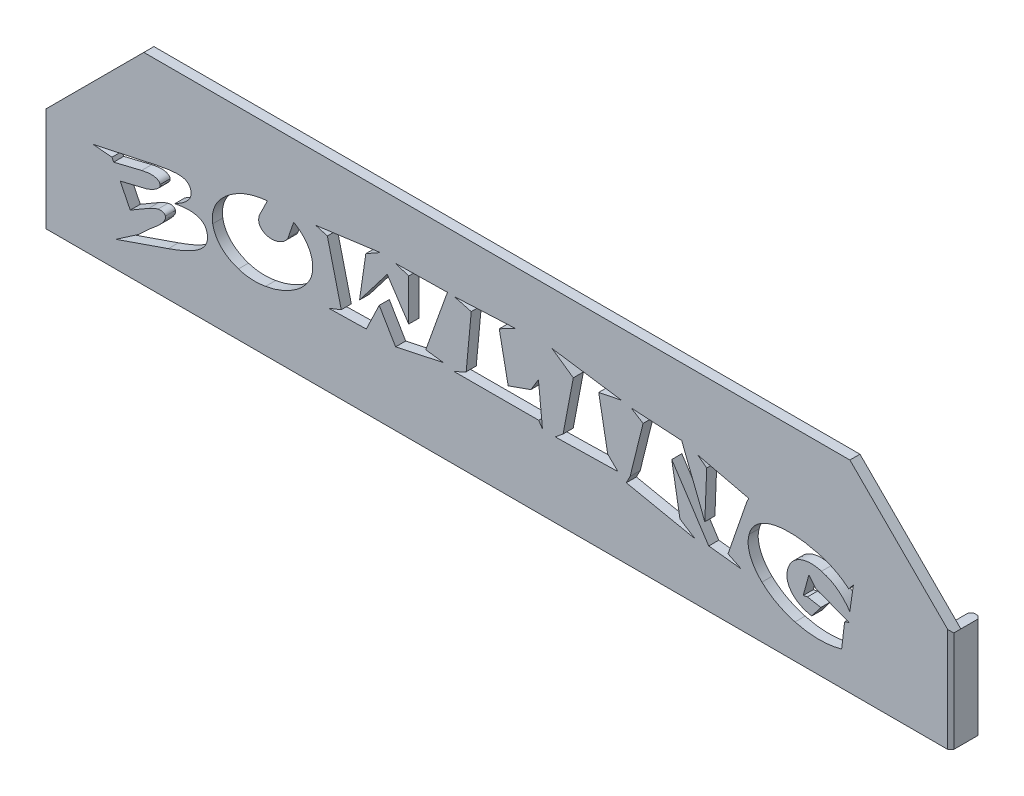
SolidWorks part; units mm, degrees
ref_plane "Plan de face" through (0, 0, 0) normal (0, 0, 1) x (1, 0, 0)
ref_plane "Plan de dessus" through (0, 0, 0) normal (0, 1, 0) x (1, 0, 0)
ref_plane "Plan de droite" through (0, 0, 0) normal (1, 0, 0) x (0, 0, -1)
sketch "Esquisse1" plane through (0, 0, 0) normal (0, 0, 1) x (1, 0, 0)
  line L0 (-90, 0) -> (90, 0)
  line L5 (90, 0) -> (90, 20)
  line L6 (90, 20) -> (70, 40)
  line L7 (70, 40) -> (-70, 40)
  line L8 (-70, 40) -> (-90, 20)
  line L9 (-90, 20) -> (-90, 0)
  point P5 (0, 0)
  dimension "D1" = 180
  dimension "D2" = 40
  dimension "D3" = 20
extrude "Boss.-Extru.1" add sketch "Esquisse1" along normal blind 2
sketch "Esquisse5" plane through (0, 0, 2) normal (0, 0, 1) x (1, 0, 0)
  line L2 (-65.1345, 8.7322) -> (-75.5242, 5.1366)
  line L3 (-75.5242, 5.1366) -> (-71.0282, 8.2263)
  line L5 (-76.3245, 18.8418) -> (-80.1002, 19.1705)
  line L6 (-80.1002, 19.1705) -> (-67.6497, 21.8601)
  line L8 (-10.188, 27.8475) -> (-14.0952, 16.8862)
  line L9 (-14.0952, 16.8862) -> (-10.611, 16.4318)
  line L10 (-10.611, 16.4318) -> (-20.0804, 14.391)
  line L11 (-20.0804, 14.391) -> (-23.3273, 19.9017)
  line L12 (-23.3273, 19.9017) -> (-25.894, 14.5453)
  line L13 (-25.894, 14.5453) -> (-33.3197, 14.3967)
  line L14 (-33.3197, 14.3967) -> (-30.8559, 15.3828)
  line L15 (-30.8559, 15.3828) -> (-33.6141, 26.6642)
  line L16 (-33.6141, 26.6642) -> (-35.9235, 27.3445)
  line L17 (-35.9235, 27.3445) -> (-23.1015, 29.0709)
  line L18 (-23.1015, 29.0709) -> (-25.9855, 27.4503)
  line L19 (-25.9855, 27.4503) -> (-27.2345, 18.8555)
  line L20 (-27.2345, 18.8555) -> (-21.7439, 26.0269)
  line L21 (-21.7439, 26.0269) -> (-17.4765, 19.5987)
  line L22 (-17.4765, 19.5987) -> (-17.4765, 27.8647)
  line L23 (-17.4765, 27.8647) -> (-20.1089, 28.725)
  line L24 (-20.1089, 28.725) -> (-9.7751, 28.8944)
  line L25 (9.0436, 14.8356) -> (8.3061, 15.9793)
  line L26 (8.3061, 15.9793) -> (-8.4174, 15.9564)
  line L27 (-8.4174, 15.9564) -> (-6.088, 17.1025)
  line L28 (-6.088, 17.1025) -> (-5.079, 27.9495)
  line L29 (-5.079, 27.9495) -> (-8.4632, 28.8499)
  line L30 (-8.4632, 28.8499) -> (3.6958, 29.433)
  line L31 (3.6958, 29.433) -> (0.466, 27.7666)
  line L32 (0.466, 27.7666) -> (2.2409, 18.8632)
  line L33 (2.2409, 18.8632) -> (6.7283, 20.4467)
  line L34 (6.7283, 20.4467) -> (8.2403, 22.9276)
  line L35 (8.2403, 22.9276) -> (9.0436, 14.8356)
  line L36 (24.0133, 15.0116) -> (11.5788, 14.7599)
  line L37 (11.5788, 14.7599) -> (13.1346, 16.0389)
  line L38 (13.1346, 16.0389) -> (15.1582, 26.6973)
  line L39 (15.1582, 26.6973) -> (10.9509, 29.6155)
  line L40 (10.9509, 29.6155) -> (24.7297, 27.6249)
  line L41 (24.7297, 27.6249) -> (20.1972, 26.7087)
  line L42 (20.1972, 26.7087) -> (21.9779, 17.005)
  line L43 (21.9779, 17.005) -> (24.0133, 15.0116)
  line L44 (49.9568, 23.3834) -> (49.5827, 22.6563)
  line L45 (49.5827, 22.6563) -> (45.8356, 11.8151)
  line L46 (45.8356, 11.8151) -> (48.4652, 10.5146)
  line L47 (48.4652, 10.5146) -> (42.0141, 11.2463)
  line L48 (42.0141, 11.2463) -> (34.6742, 22.4277)
  line L49 (34.6742, 22.4277) -> (36.3091, 13.0127)
  line L50 (36.3091, 13.0127) -> (39.3188, 11.1148)
  line L51 (39.3188, 11.1148) -> (25.6657, 13.9257)
  line L53 (26.4279, 15.426) -> (28.9917, 25.7871)
  line L54 (28.9917, 25.7871) -> (26.6303, 27.2635)
  line L55 (26.6303, 27.2635) -> (36.646, 26.6732)
  line L56 (36.646, 26.6732) -> (41.2335, 15.0116)
  line L57 (41.2335, 15.0116) -> (41.6108, 24.4409)
  line L58 (41.6108, 24.4409) -> (39.793, 25.7957)
  line L59 (39.793, 25.7957) -> (49.9568, 23.3834)
  line L60 (69.8672, 12.0374) -> (68.9433, 11.6799)
  line L61 (68.9433, 11.6799) -> (68.363, 6.7094)
  line L62 (69.7607, 17.7593) -> (70.6868, 18.8998)
  line L63 (70.6868, 18.8998) -> (69.9824, 13.9257)
  line L64 (62.4379, 9.4304) -> (64.2415, 11.7999)
  line L65 (64.2415, 11.7999) -> (61.5776, 12.283)
  line L66 (61.5776, 12.283) -> (60.739, 12.1058)
  line L67 (60.739, 12.1058) -> (61.8691, 16.2102)
  line L68 (61.8691, 16.2102) -> (63.222, 14.5453)
  line L69 (63.222, 14.5453) -> (69.8672, 12.0374)
  line L70 (-10.188, 27.8475) -> (-9.7751, 28.8944)
  line L72 (26.4279, 15.426) -> (25.6657, 13.9257)
  line L73 (-46.7742, 24.1553) -> (-45.4965, 26.7449)
  line L75 (-46.9028, 26.5791) -> (-45.4965, 26.7449)
  line L78 (-41.395, 22.4804) -> (-40.2894, 25.691)
  line L79 (-70.4394, 19.5049) -> (-75.9818, 18.1549)
  line L80 (-69.419, 16.8439) -> (-74.6874, 15.5606)
  line L81 (-69.036, 13.697) -> (-72.6959, 11.569)
  line L82 (-68.6873, 10.4014) -> (-71.0282, 8.2263)
  line L83 (-75.9818, 18.1549) -> (-76.3245, 18.8418)
  line L85 (-72.6959, 11.569) -> (-74.6874, 15.5606)
  spline S0 degree 3 poles (-68.6873, 10.4014) (-68.4284, 10.6047) (-68.0569, 10.9053) (-67.5898, 11.3091) (-67.2791, 11.5883) (-66.9949, 11.8539) (-66.74, 12.1081) (-66.5146, 12.3508) (-66.3159, 12.5794) (-66.1455, 12.7976) (-66.0038, 13.0056) (-65.8833, 13.2001) (-65.7947, 13.3853) (-65.7327, 13.5596) (-65.686, 13.769) (-65.692, 13.9247) (-65.7147, 14.0199) knots 0 0 0 0 0.2042 0.296389 0.383025 0.463309 0.537702 0.60629 0.668733 0.7256 0.777898 0.82483 0.867394 0.904967 0.939396 1 1 1 1
  spline S1 degree 3 poles (-65.7147, 14.0199) (-65.7435, 14.1306) (-65.837, 14.2885) (-66.0435, 14.425) (-66.236, 14.5022) (-66.4574, 14.5493) (-66.7907, 14.5682) (-67.0466, 14.5265) (-67.2182, 14.483) knots 0 0 0 0 0.198119 0.302488 0.423844 0.555583 0.6928 1 1 1 1
  spline S2 degree 3 poles (-67.2182, 14.483) (-67.5118, 14.408) (-67.9582, 14.2378) (-68.5591, 13.9599) (-68.8759, 13.79) (-69.036, 13.697) knots 0 0 0 0 0.457042 0.720468 1 1 1 1
  spline S3 degree 3 poles (-69.419, 16.8439) (-69.0237, 16.9869) (-68.4661, 17.2145) (-67.7991, 17.5882) (-67.457, 17.8277) (-67.2246, 18.0235) (-67.0812, 18.1622) (-66.9653, 18.2987) (-66.8723, 18.4283) (-66.8078, 18.5565) (-66.7562, 18.7169) (-66.7616, 18.8406) (-66.778, 18.9161) knots 0 0 0 0 0.35546 0.507236 0.645274 0.707533 0.763891 0.813576 0.858687 0.898289 0.934453 1 1 1 1
  spline S4 degree 3 poles (-66.778, 18.9161) (-66.8038, 19.0218) (-66.8746, 19.1706) (-67.0127, 19.3414) (-67.1441, 19.4511) (-67.3014, 19.5424) (-67.4831, 19.6191) (-67.6889, 19.6817) (-67.919, 19.7257) (-68.1691, 19.7573) (-68.4394, 19.7708) (-68.7276, 19.7677) (-69.0346, 19.7461) (-69.3599, 19.7126) (-69.704, 19.6601) (-70.0663, 19.5914) (-70.3132, 19.5356) (-70.4394, 19.5049) knots 0 0 0 0 0.080612 0.120925 0.16269 0.2072 0.255804 0.30919 0.367042 0.429929 0.496679 0.568303 0.644339 0.725624 0.811669 0.903319 1 1 1 1
  spline S5 degree 3 poles (-63.8654, 17.0811) (-63.4316, 17.1749) (-62.7948, 17.2793) (-61.9652, 17.3749) (-61.3982, 17.4048) (-60.8659, 17.4096) (-60.3689, 17.3834) (-59.9078, 17.3195) (-59.4823, 17.2305) (-59.0951, 17.1067) (-58.7426, 16.9577) (-58.4322, 16.7703) (-58.1604, 16.5548) (-57.927, 16.3091) (-57.6716, 15.9305) (-57.5445, 15.6075) (-57.4859, 15.3833) knots 0 0 0 0 0.182781 0.2657 0.343928 0.416542 0.484951 0.548731 0.608164 0.663775 0.715984 0.76546 0.81266 0.858475 0.904526 1 1 1 1
  spline S6 degree 3 poles (-57.4859, 15.3833) (-57.4045, 15.0727) (-57.3441, 14.5959) (-57.4135, 13.9691) (-57.5396, 13.5206) (-57.7337, 13.0843) (-58.0002, 12.6618) (-58.3386, 12.2542) (-58.7513, 11.8604) (-59.2417, 11.4713) (-59.8193, 11.0841) (-60.4857, 10.695) (-61.2414, 10.3026) (-62.087, 9.9118) (-63.3835, 9.3582) (-64.4164, 8.9827) (-65.1345, 8.7322) knots 0 0 0 0 0.086802 0.128255 0.169668 0.212199 0.256846 0.304216 0.355016 0.410704 0.473185 0.542774 0.619121 0.703203 0.794445 1 1 1 1
  spline S7 degree 3 poles (-67.6497, 21.8601) (-67.0989, 21.9811) (-66.3023, 22.1341) (-65.2791, 22.3011) (-64.6089, 22.3876) (-64.0006, 22.4425) (-63.457, 22.4709) (-62.9759, 22.4659) (-62.554, 22.4346) (-62.1814, 22.3686) (-61.8506, 22.273) (-61.5583, 22.1447) (-61.3051, 21.983) (-61.0915, 21.7892) (-60.8489, 21.4871) (-60.7405, 21.2116) (-60.69, 21.0226) knots 0 0 0 0 0.221364 0.318321 0.406917 0.486517 0.558025 0.620483 0.675267 0.723902 0.768749 0.810099 0.848792 0.886124 0.922861 1 1 1 1
  spline S8 degree 3 poles (-60.69, 21.0226) (-60.6492, 20.8575) (-60.612, 20.6031) (-60.6363, 20.264) (-60.6857, 20.0127) (-60.7664, 19.762) (-60.8817, 19.5126) (-61.032, 19.2666) (-61.2142, 19.023) (-61.4266, 18.7777) (-61.6778, 18.5372) (-61.9566, 18.2899) (-62.2734, 18.0479) (-62.6224, 17.8046) (-63.1513, 17.4725) (-63.569, 17.2301) (-63.8654, 17.0811) knots 0 0 0 0 0.093707 0.139931 0.186385 0.234281 0.284461 0.337127 0.392573 0.451632 0.515373 0.583701 0.656551 0.734473 0.817632 1 1 1 1
  spline S9 degree 3 poles (-46.7742, 24.1553) (-46.8677, 24.0073) (-46.9844, 23.7751) (-47.1069, 23.4553) (-47.1687, 23.2144) (-47.2095, 22.9743) (-47.2312, 22.6565) (-47.221, 22.4187) (-47.1915, 22.2632) knots 0 0 0 0 0.26485 0.392709 0.518019 0.640912 0.761002 1 1 1 1
  spline S10 degree 3 poles (-47.1915, 22.2632) (-47.1679, 22.1266) (-47.1085, 21.9255) (-46.9774, 21.6795) (-46.8543, 21.5066) (-46.7021, 21.3498) (-46.5314, 21.1989) (-46.331, 21.0666) (-46.1137, 20.9407) (-45.8791, 20.8337) (-45.634, 20.7474) (-45.3825, 20.6822) (-45.1246, 20.6354) (-44.8605, 20.6136) (-44.496, 20.6096) (-44.2202, 20.6381) (-44.036, 20.6683) knots 0 0 0 0 0.10657 0.159654 0.213724 0.269165 0.327323 0.388475 0.453435 0.5203 0.586325 0.652949 0.719906 0.787549 0.856406 1 1 1 1
  spline S11 degree 3 poles (-44.036, 20.6683) (-43.7415, 20.7163) (-43.3086, 20.8371) (-42.7688, 21.0899) (-42.3923, 21.3193) (-42.0552, 21.5775) (-41.688, 21.9407) (-41.483, 22.2564) (-41.395, 22.4804) knots 0 0 0 0 0.268678 0.402324 0.536005 0.66513 0.784106 1 1 1 1
  spline S13 degree 3 poles (-36.5931, 20.7941) (-36.5346, 20.4601) (-36.4931, 19.9571) (-36.5219, 19.2922) (-36.5916, 18.8101) (-36.7036, 18.3373) (-36.9154, 17.7132) (-37.1434, 17.2684) (-37.3191, 16.984) knots 0 0 0 0 0.256181 0.380223 0.502479 0.623918 0.747165 1 1 1 1
  spline S14 degree 3 poles (-37.3191, 16.984) (-37.5104, 16.6672) (-37.8389, 16.2118) (-38.3375, 15.6442) (-38.7551, 15.2323) (-39.2056, 14.8325) (-39.6943, 14.4479) (-40.2196, 14.0804) (-40.7787, 13.7312) (-41.3599, 13.4002) (-41.9626, 13.1014) (-42.5761, 12.8249) (-43.2071, 12.5835) (-43.8494, 12.3656) (-44.7302, 12.1117) (-45.4059, 11.9681) (-45.8624, 11.8907) knots 0 0 0 0 0.108446 0.164268 0.22136 0.280336 0.340811 0.403591 0.468238 0.534043 0.599636 0.665418 0.731308 0.797657 0.864238 1 1 1 1
  spline S15 degree 3 poles (-45.8624, 11.8907) (-46.3416, 11.8142) (-47.0562, 11.7226) (-48.0031, 11.6931) (-48.6876, 11.7081) (-49.3536, 11.77) (-50.2118, 11.8955) (-50.8362, 12.0601) (-51.2416, 12.1908) knots 0 0 0 0 0.267704 0.396483 0.522081 0.644983 0.765048 1 1 1 1
  spline S16 degree 3 poles (-51.2416, 12.1908) (-51.5855, 12.3053) (-52.0888, 12.4943) (-52.7239, 12.8053) (-53.1693, 13.0535) (-53.5923, 13.3199) (-53.9904, 13.6082) (-54.3609, 13.9207) (-54.709, 14.2486) (-55.024, 14.5972) (-55.3125, 14.957) (-55.5635, 15.3331) (-55.7855, 15.7202) (-55.9743, 16.1218) (-56.1856, 16.6764) (-56.2905, 17.1109) (-56.3407, 17.4042) knots 0 0 0 0 0.141749 0.2097 0.276216 0.340993 0.404978 0.468154 0.530318 0.59174 0.651643 0.710412 0.768287 0.825925 0.883676 1 1 1 1
  spline S17 degree 3 poles (-56.3407, 17.4042) (-56.4166, 17.853) (-56.4452, 18.5411) (-56.3115, 19.4505) (-56.1193, 20.1268) (-55.8482, 20.7942) (-55.3596, 21.6765) (-54.8883, 22.2863) (-54.5314, 22.6662) knots 0 0 0 0 0.236513 0.355212 0.476628 0.601298 0.729021 1 1 1 1
  spline S18 degree 3 poles (-54.5314, 22.6662) (-54.3046, 22.9186) (-53.9358, 23.2721) (-53.4214, 23.7239) (-53.0086, 24.0407) (-52.5817, 24.3498) (-52.1338, 24.6399) (-51.6655, 24.9145) (-51.1818, 25.1769) (-50.6824, 25.4225) (-50.1711, 25.6478) (-49.6505, 25.8537) (-49.1205, 26.0402) (-48.5806, 26.2054) (-47.8442, 26.4014) (-47.2817, 26.5155) (-46.9028, 26.5791) knots 0 0 0 0 0.116521 0.175488 0.235231 0.295306 0.35662 0.418572 0.481875 0.545732 0.609809 0.673907 0.738123 0.802868 0.867927 1 1 1 1
  spline S21 degree 3 poles (68.363, 6.7094) (67.6054, 6.5063) (66.455, 6.278) (64.908, 6.1282) (63.7544, 6.0925) (62.6, 6.1398) (61.0412, 6.3051) (59.8819, 6.5504) (59.1138, 6.7551) knots 0 0 0 0 0.251401 0.375055 0.497884 0.621061 0.745143 1 1 1 1
  spline S22 degree 3 poles (59.1138, 6.7551) (58.485, 6.9257) (57.5584, 7.228) (56.3741, 7.7442) (55.5202, 8.1704) (54.7071, 8.643) (53.6961, 9.3265) (52.9917, 9.8984) (52.5599, 10.3136) knots 0 0 0 0 0.25953 0.387329 0.514261 0.63941 0.761596 1 1 1 1
  spline S23 degree 3 poles (52.5599, 10.3136) (52.2926, 10.5788) (51.9012, 10.9768) (51.4428, 11.5474) (51.131, 11.971) (50.855, 12.4025) (50.6074, 12.8379) (50.3927, 13.279) (50.2088, 13.7243) (50.0616, 14.1718) (49.9441, 14.617) (49.8694, 15.0601) (49.8209, 15.5001) (49.8123, 15.9372) (49.8529, 16.5162) (49.9262, 16.9453) (50.0046, 17.2248) knots 0 0 0 0 0.146093 0.215956 0.283634 0.349929 0.414441 0.477715 0.540001 0.601094 0.660225 0.718343 0.775168 0.831696 0.887597 1 1 1 1
  spline S24 degree 3 poles (50.0046, 17.2248) (50.0739, 17.4848) (50.2067, 17.8649) (50.4457, 18.3412) (50.6498, 18.6806) (50.8803, 19.0043) (51.1436, 19.3073) (51.4291, 19.5978) (51.7448, 19.8686) (52.0847, 20.1227) (52.4478, 20.358) (52.8363, 20.5686) (53.245, 20.7638) (53.6784, 20.9382) (54.2966, 21.1469) (54.7808, 21.2627) (55.1094, 21.3321) knots 0 0 0 0 0.116605 0.173859 0.230732 0.288149 0.345843 0.40454 0.464564 0.525933 0.588363 0.651942 0.717335 0.784591 0.854329 1 1 1 1
  spline S25 degree 3 poles (55.1094, 21.3321) (55.7622, 21.4683) (56.7683, 21.5899) (58.1363, 21.6323) (59.2061, 21.5952) (60.3086, 21.4993) (61.8481, 21.2689) (63.009, 21.0129) (63.787, 20.8005) knots 0 0 0 0 0.227878 0.345901 0.467842 0.593794 0.724218 1 1 1 1
  spline S26 degree 3 poles (63.787, 20.8005) (64.3713, 20.6413) (65.2292, 20.3717) (66.3232, 19.9167) (67.1, 19.5516) (67.8328, 19.1472) (68.7434, 18.5857) (69.3699, 18.1012) (69.7607, 17.7593) knots 0 0 0 0 0.268828 0.398299 0.525576 0.649511 0.769527 1 1 1 1
  spline S27 degree 3 poles (69.9824, 13.9257) (69.8913, 14.1115) (69.652, 14.4052) (69.3233, 14.8353) (69.0007, 15.2149) (68.6682, 15.5691) (68.3309, 15.9023) (67.9848, 16.2104) (67.6317, 16.4985) (67.2682, 16.7646) (66.8921, 17.0112) (66.5041, 17.2396) (66.1029, 17.4495) (65.6877, 17.6368) (65.1166, 17.8684) (64.6729, 18.0079) (64.373, 18.0909) knots 0 0 0 0 0.086573 0.157745 0.227509 0.295385 0.36153 0.426364 0.489731 0.552655 0.615297 0.67837 0.741485 0.80517 0.869379 1 1 1 1
  spline S28 degree 3 poles (64.373, 18.0909) (63.9795, 18.1964) (63.3925, 18.3175) (62.6145, 18.39) (62.0634, 18.3943) (61.532, 18.3467) (61.0192, 18.2609) (60.526, 18.122) (60.0576, 17.9367) (59.616, 17.713) (59.215, 17.4451) (58.8502, 17.1439) (58.5281, 16.8008) (58.2475, 16.4195) (57.9236, 15.8497) (57.7474, 15.3822) (57.6618, 15.0554) knots 0 0 0 0 0.147599 0.216575 0.282854 0.346954 0.409665 0.470976 0.532194 0.591941 0.649961 0.706579 0.76299 0.820019 0.877693 1 1 1 1
  spline S29 degree 3 poles (57.6618, 15.0554) (57.5821, 14.7655) (57.5103, 14.3239) (57.5134, 13.7372) (57.5645, 13.3129) (57.6684, 12.8981) (57.8252, 12.4934) (58.0284, 12.0965) (58.2846, 11.7156) (58.5788, 11.3516) (58.9143, 11.015) (59.2838, 10.7051) (59.6915, 10.4255) (60.1338, 10.1725) (60.7874, 9.8703) (61.3091, 9.6909) (61.6719, 9.5962) knots 0 0 0 0 0.118797 0.17566 0.23143 0.287325 0.344183 0.402625 0.463201 0.525307 0.58735 0.650705 0.715677 0.782469 0.851878 1 1 1 1
  spline S30 degree 3 poles (61.6719, 9.5962) (61.7077, 9.59) (61.7723, 9.57) (61.8779, 9.5492) (62.0972, 9.4992) (62.2876, 9.463) (62.4379, 9.4304) knots 0 0 0 0 0.138889 0.258339 0.411408 1 1 1 1
  spline S31 degree 3 poles (-40.2894, 25.691) (-40.2854, 25.6889) (-40.1321, 25.6054) (-39.8346, 25.4339) (-39.418, 25.1455) (-39.0189, 24.8368) (-38.6409, 24.5024) (-38.2886, 24.1426) (-37.9598, 23.7667) (-37.6624, 23.3769) (-37.4023, 22.9728) (-37.1671, 22.5623) (-36.9753, 22.1347) (-36.7547, 21.5537) (-36.6445, 21.1) (-36.5931, 20.7941) knots 0.197349 0.197349 0.197349 0.197349 0.199081 0.263559 0.327528 0.391159 0.45492 0.518824 0.582109 0.644285 0.704644 0.764368 0.823573 0.882255 1 1 1 1
extrude "Enlèv. mat.-Extru.3" cut sketch "Esquisse5" against normal blind 10
sketch "Esquisse6" plane through (0, 0, 0) normal (0, 0, -1) x (-1, 0, 0)
  line L1 (-90, 0) -> (-88, 0)
  line L2 (-90, 0) -> (-90, 20)
  line L3 (-90, 20) -> (-88, 20)
  line L4 (-88, 0) -> (-88, 20)
  line L5 (90, 0) -> (88, 0)
  line L6 (90, 0) -> (90, 20)
  line L7 (90, 20) -> (88, 20)
  line L8 (88, 0) -> (88, 20)
  dimension "D1" = 20
  dimension "D2" = 2
extrude "Boss.-Extru.2" add sketch "Esquisse6" along normal blind 4
chamfer "Chanfrein1" distance 0.6 angle 45 6 edges at (-90, 10, -4) (-88, 10, -4) (88, 10, -4) (90, 10, -4) (90, 10, 2) (-90, 10, 2)
